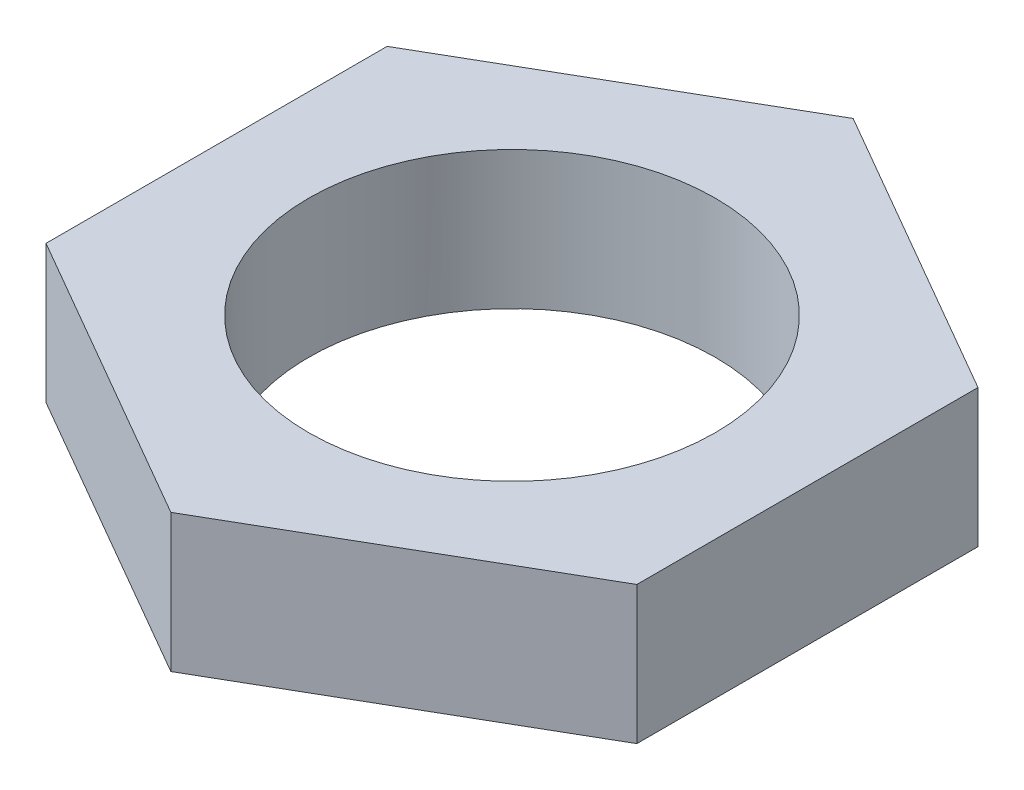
SolidWorks part; units mm, degrees
ref_plane "Front" through (0, 0, 0) normal (0, 0, 1) x (1, 0, 0)
ref_plane "Top" through (0, 0, 0) normal (0, 1, 0) x (1, 0, 0)
ref_plane "Right" through (0, 0, 0) normal (1, 0, 0) x (0, 0, -1)
sketch "Sketch1" plane through (0, 0, 0) normal (0, 1, 0) x (1, 0, 0)
  line L0 (0, 0) -> (0, 17.3205) construction
  line L1 (0, 17.3205) -> (-15, 8.6603)
  line L2 (-15, 8.6603) -> (-15, -8.6603)
  line L3 (-15, -8.6603) -> (0, -17.3205)
  line L4 (0, -17.3205) -> (15, -8.6603)
  line L5 (15, -8.6603) -> (15, 8.6603)
  line L6 (15, 8.6603) -> (0, 17.3205)
  circle A0 centre (0, 0) radius 15 construction
  dimension "D1" = 30
extrude "Extrude1" add sketch "Sketch1" along normal blind 7
hole_wizard "7/8-14 Tapped Hole2" positions "Sketch4" profile "Sketch3" tap size "7/8-14" standard "ANSI Inch"
sketch "Sketch4" plane through (0, 0, 0) normal (0, -1, 0) x (-1, 0, 0)
  point P0 (0, 0)
sketch "Sketch3" plane through (0, 0, 0) normal (1, 0, 0) x (0, 0, -1)
  line L0 (0, 0) -> (0, 49.89)
  line L1 (0, 49.89) -> (10.3187, 49.89)
  line L2 (10.3187, 49.89) -> (10.3187, 0)
  line L5 (10.3187, 0) -> (0, 0)
  line L10 (0, 49.89) -> (-10.3188, 49.89) construction
  line L11 (0, -6.35) -> (0, 107.95) construction
  dimension "Tap Drill Dia." = 20.6375
  dimension "Tap Drill Depth" = 49.89
  dimension "Drill Angle" = 180
